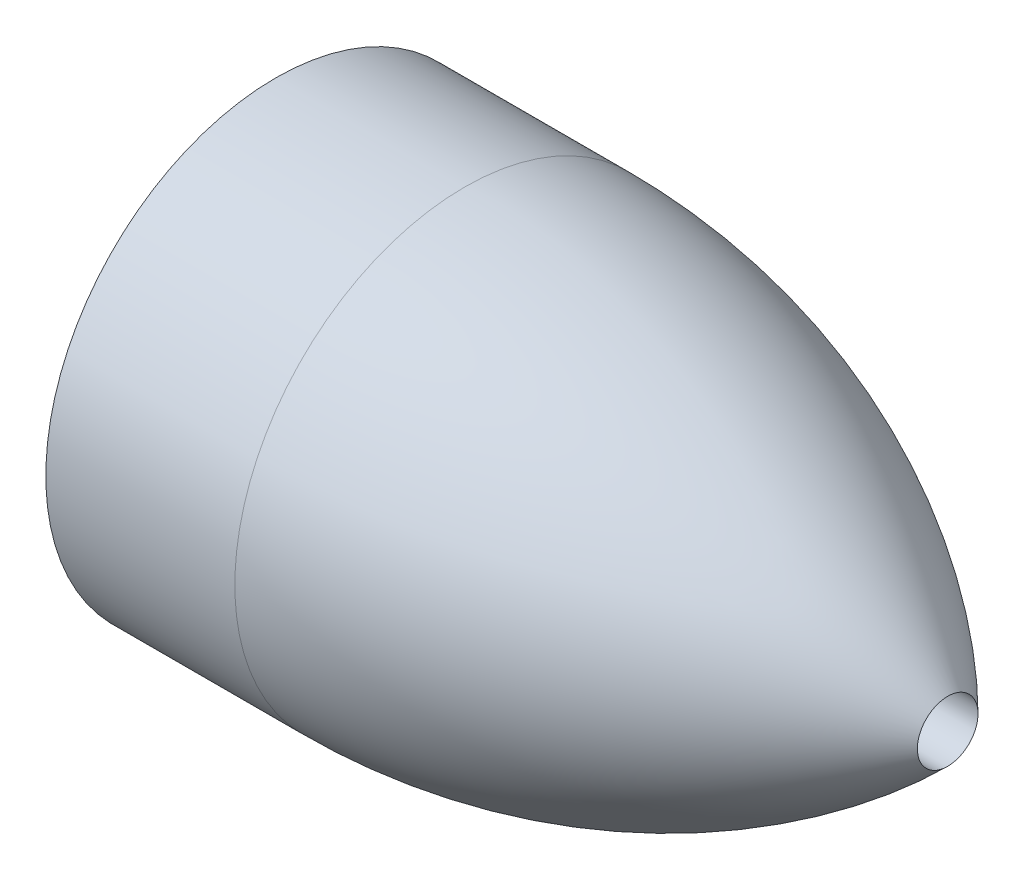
SolidWorks part; units mm, degrees
ref_plane "Front Plane" through (0, 0, 0) normal (0, 0, 1) x (1, 0, 0)
ref_plane "Top Plane" through (0, 0, 0) normal (0, 1, 0) x (1, 0, 0)
ref_plane "Right Plane" through (0, 0, 0) normal (1, 0, 0) x (0, 0, -1)
sketch "Sketch1" plane through (0, 0, 0) normal (0, 0, 1) x (1, 0, 0)
  line L0 (28.047, 34.0995) -> (0, 34.0995)
  line L1 (101.6, 0) -> (0, 0) construction
  line L2 (134.5956, 0) -> (-134.5956, 0) construction
  line L3 (0, 0) -> (0, 34.0995)
  line L4 (0, 29.337) -> (41.275, 29.337)
  line L5 (41.275, 29.337) -> (45.5483, 22.225)
  line L6 (45.5483, 22.225) -> (67.5091, 22.225)
  line L7 (67.5091, 22.225) -> (73.2323, 12.7)
  line L8 (73.2323, 12.7) -> (85.0562, 12.7)
  line L9 (85.0562, 12.7) -> (92.6872, 0)
  line L10 (41.275, 29.337) -> (41.275, 33.2347) construction
  line L11 (67.5091, 22.225) -> (67.5091, 26.1227) construction
  line L12 (85.0562, 12.7) -> (85.0562, 16.5977) construction
  line L13 (0, -24.6194) -> (0, 24.6194) construction
  line L14 (0, 34.0995) -> (-43.0496, 34.0995)
  line L15 (-43.0496, 34.0995) -> (-101.8443, 12.7)
  line L16 (0, 20.0025) -> (-41.91, 20.0025)
  line L17 (-41.91, 20.0025) -> (-46.2978, 12.7)
  line L18 (-46.2978, 12.7) -> (-84.3978, 12.7)
  line L19 (-84.3978, 12.7) -> (-91.1274, 1.5)
  line L20 (-91.1274, 1.5) -> (-117.7193, 1.5)
  line L21 (-101.8443, 12.7) -> (-117.7193, 12.7)
  line L22 (-117.7193, 12.7) -> (-117.7193, 1.5)
  line L23 (-84.3978, 12.7) -> (-84.3978, 19.05) construction
  line L24 (-101.8443, 12.7) -> (-101.8443, 44.7625)
  line L25 (-101.8443, 44.7625) -> (-143.1193, 44.7625)
  line L26 (-143.1193, 44.7625) -> (-143.1193, 0)
  line L27 (-143.1193, 0) -> (-117.7193, 0)
  line L28 (-117.7193, 0) -> (-117.7193, 12.7)
  line L29 (-143.1193, 40) -> (-117.7193, 40)
  line L30 (-117.7193, 40) -> (-117.7193, 12.7)
  line L31 (92.6872, 0) -> (101.6, 0)
  line L32 (0, 29.337) -> (0, 34.0995)
  arc A0 (99.7302, 4.5) -> (28.047, 34.0995) centre (28.047, -67.5005) ccw
  arc A1 (101.6, 0) -> (99.7302, 4.5) centre (95.25, 0) ccw
  dimension "D1" = 6.35
  dimension "D2" = 95.25
  dimension "D6" = 101.6
  dimension "D3" = 29.337
  dimension "D4" = 4.7625
  dimension "D5" = 41.275
  dimension "D7" = 59
  dimension "D8" = 12.7
  dimension "D9" = 22.225
  dimension "D10" = 20
  dimension "D11" = 41.91
  dimension "D12" = 20.0025
  dimension "D13" = 59
  dimension "D14" = 12.7
  dimension "D15" = 38.1
  dimension "D16" = 1.5
  dimension "D17" = 6.35
  dimension "D18" = 15.875
  dimension "D19" = 12.7
  dimension "D20" = 25.4
  dimension "D21" = 4.7625
  dimension "D22" = 40
revolve "Revolve1" add sketch "Sketch1" angle 360 about L1
sketch "Sketch2" plane through (0, 0, 0) normal (1, 0, 0) x (0, 0, -1)
  circle A0 centre (0, 0) radius 4.5 construction
  circle A1 centre (0, 0) radius 4.5
extrude "Cut-Extrude2" cut sketch "Sketch2" along normal through all
